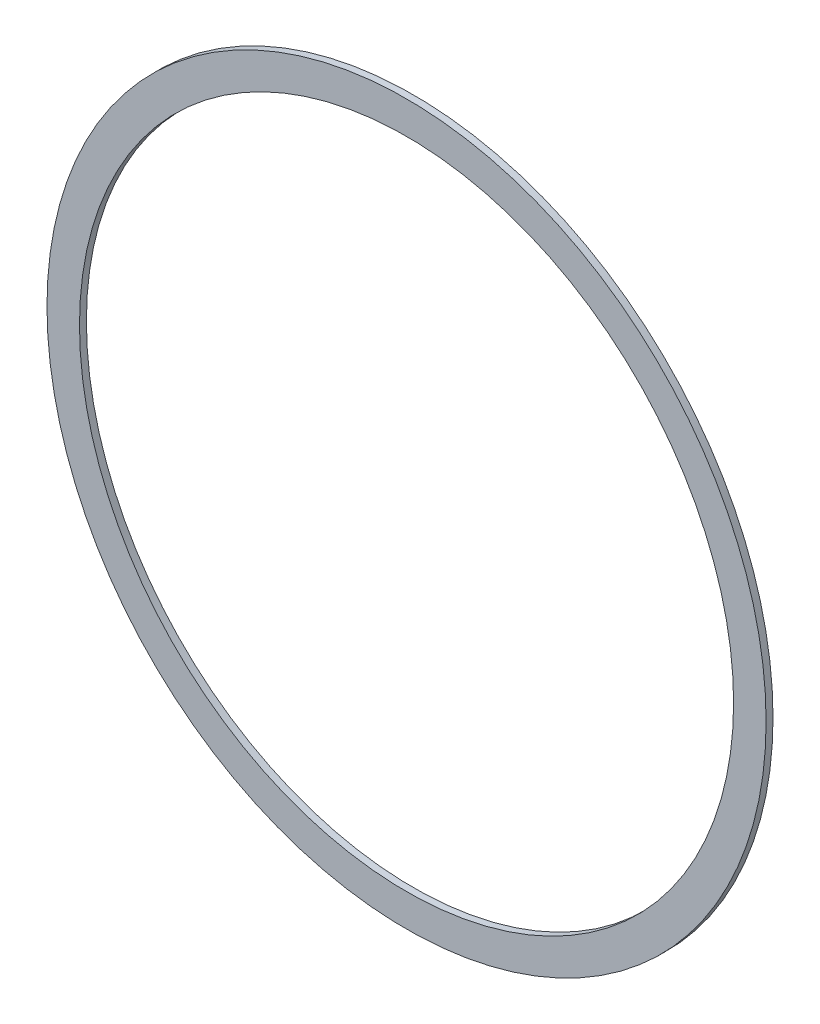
SolidWorks part; units mm, degrees
ref_plane "Plan1" through (0, 0, 0) normal (0, 0, 1) x (1, 0, 0)
ref_plane "Plan2" through (0, 0, 0) normal (0, 1, 0) x (1, 0, 0)
ref_plane "Plan3" through (0, 0, 0) normal (1, 0, 0) x (0, 0, -1)
sketch "Esquisse1" plane through (0, 0, 0) normal (0, 0, 1) x (1, 0, 0)
  circle A0 centre (0, 24.7771) radius 23.65
  circle A1 centre (0, 24.7771) radius 26
  arc A2 (21.3134, 35.0271) -> (-21.3134, 35.0271) centre (0, 24.7771) ccw construction
  dimension "D1" = 52
extrude "Base-Extrusion" add sketch "Esquisse1" along normal blind 0.5
